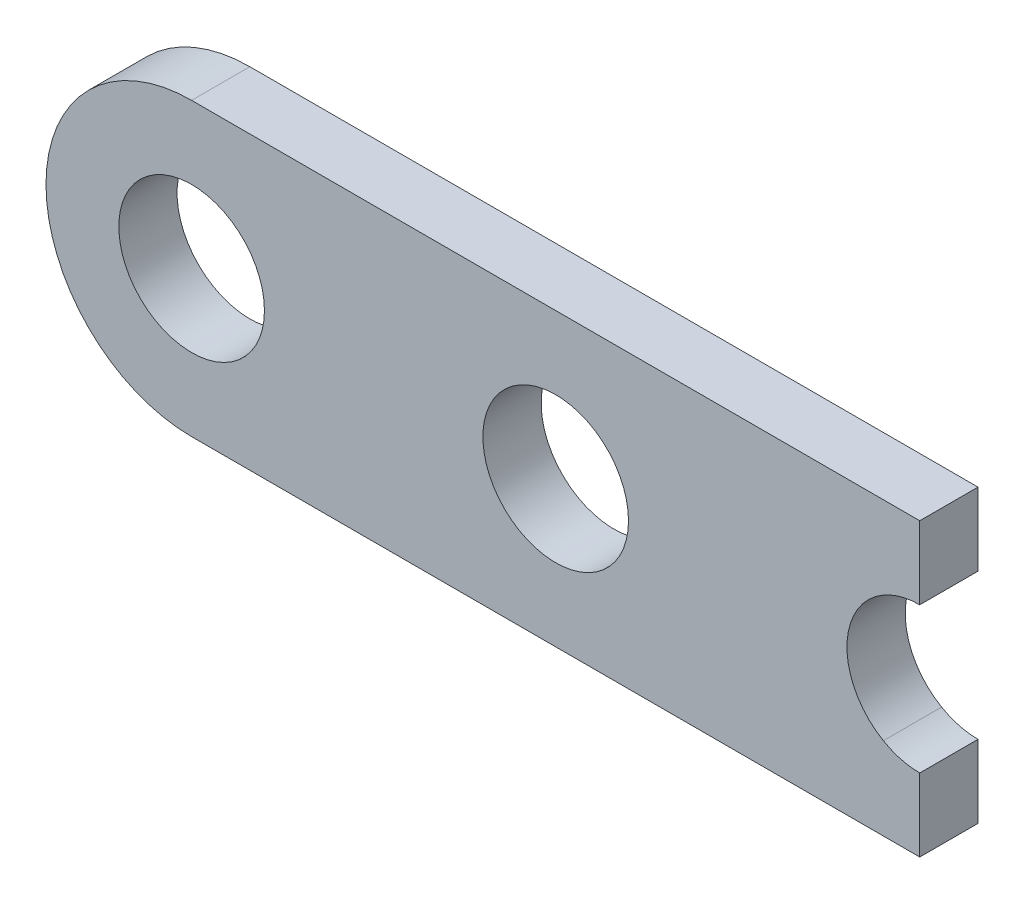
SolidWorks part; units mm, degrees
ref_plane "Front" through (0, 0, 0) normal (0, 0, 1) x (1, 0, 0)
ref_plane "Top" through (0, 0, 0) normal (0, 1, 0) x (1, 0, 0)
ref_plane "Right" through (0, 0, 0) normal (1, 0, 0) x (0, 0, -1)
sketch "Sketch1" plane through (0, 0, 0) normal (0, 0, 1) x (1, 0, 0)
  line L0 (250, 222.6284) -> (250, -151.5336) construction
  line L1 (0, 0) -> (500, 0)
  line L3 (0, 100) -> (500, 100)
  arc A0 (0, 100) -> (0, 0) centre (0, 50) ccw
  arc A1 (500, 100) -> (500, 0) centre (500, 50) cw
  point P1 (250, 0)
  point P10 (250, 100)
  dimension "D2" = 500
  dimension "D1" = 100
extrude "Base-Extrude" add sketch "Sketch1" along normal blind 20
sketch "Sketch2" plane through (0, 0, 20) normal (0, 0, 1) x (1, 0, 0)
  circle A0 centre (0, 50) radius 25
  arc A1 (0, 100) -> (0, 0) centre (0, 50) ccw construction
  dimension "D1" = 50
extrude "Cut-Extrude1" cut sketch "Sketch2" against normal through all
pattern_linear "LPattern1" count 5 spacing 125 along (1, 0, 0) of "Cut-Extrude1"
sketch "Sketch6" plane through (0, 0, 0) normal (0, 1, 0) x (1, 0, 0)
  line L0 (250, 24.303) -> (250, -37.3782) construction
  line L1 (250, 0) -> (250, -20) construction
  line L2 (500, -20) -> (0, -20) construction
  line L3 (500, 0) -> (0, 0) construction
  line L4 (262.5, -20) -> (237.5, -20)
  line L5 (262.5, 0) -> (237.5, 0)
  line L6 (262.5, 0) -> (262.5, -20)
  line L7 (237.5, 0) -> (237.5, -20)
  dimension "D1" = 25
fillet "Fillet1" radius 3
sketch "Sketch3" plane through (0, 0, 20) normal (0, 0, 1) x (1, 0, 0)
  line L0 (250, 189.4512) -> (250, -67.8587)
  circle A0 centre (0, 50) radius 25 construction
  dimension "D1" = 250
extrude "Cut-Extrude2" cut sketch "Sketch3" against normal through all and the other way through all
equation "\"D3@LPattern1\" = \"D2@Sketch1\" / (\"D1@LPattern1\"-1)"
